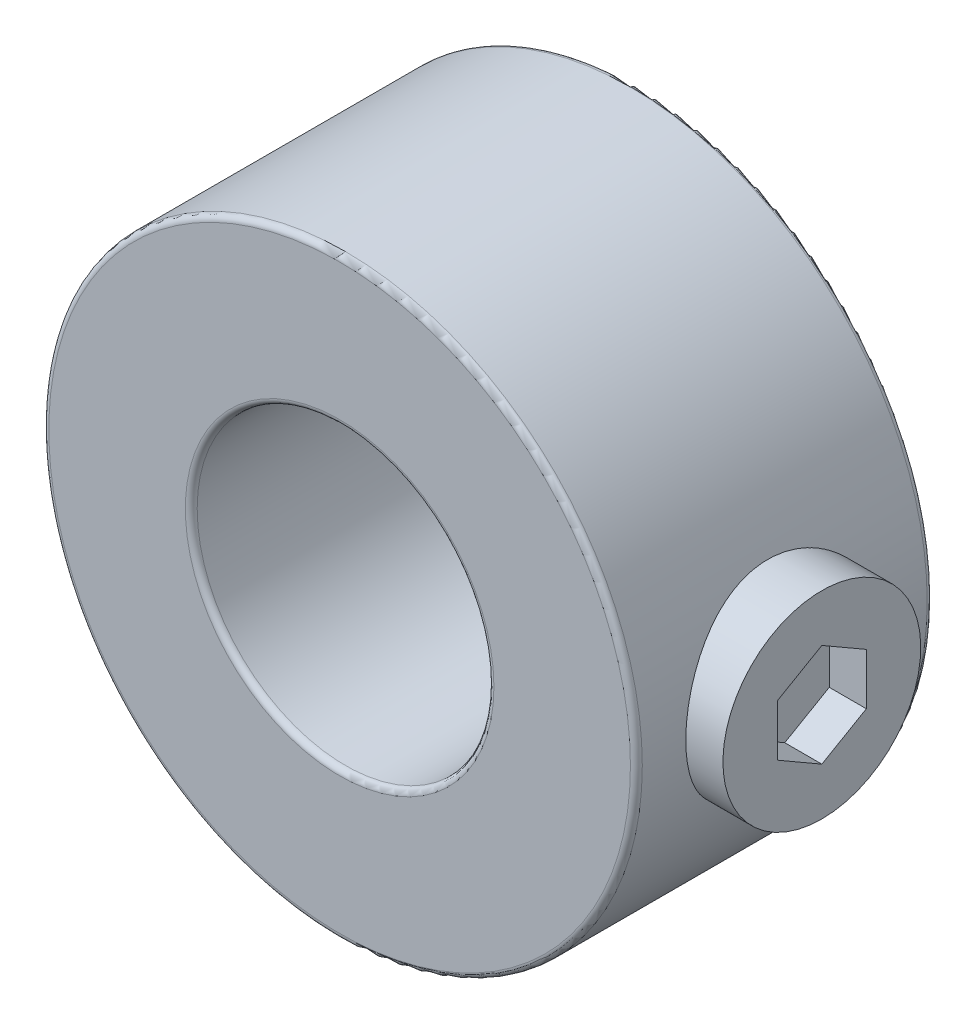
SolidWorks part; units mm, degrees
ref_plane "Front Plane" through (0, 0, 0) normal (0, 0, 1) x (1, 0, 0)
ref_plane "Top Plane" through (0, 0, 0) normal (0, 1, 0) x (1, 0, 0)
ref_plane "Right Plane" through (0, 0, 0) normal (1, 0, 0) x (0, 0, -1)
sketch "Sketch1" plane through (0, 0, 0) normal (0, 0, 1) x (1, 0, 0)
  circle A0 centre (0, 0) radius 9.525
  circle A1 centre (0, 0) radius 4.7625
  point P4 (9.525, 0)
  dimension "Bore Dia" = 9.525
  dimension "OD" = 19.05
extrude "Extrude1" add sketch "Sketch1" along normal blind 9.525
ref_plane "Plane1" through (9.525, 0, 0) normal (1, 0, 0) x (0, 0, -1)
sketch "Sketch2" plane through (9.525, 0, 0) normal (1, 0, 0) x (0, 0, -1)
  line L0 (0, 0) -> (-9.525, 0) construction
  line L1 (-9.525, 9.525) -> (-9.525, -9.525) construction
  circle A0 centre (-4.7625, 0) radius 3.175
  dimension "Set Screw Dia" = 6.35
extrude "Cut-Extrude1" cut sketch "Sketch2" against normal up to surface (9.525 mm away)
ref_plane "Plane2" through (0, 0, 4.7625) normal (0, 0, 1) x (1, 0, 0)
sketch "Sketch3" plane through (0, 0, 4.7625) normal (0, 0, 1) x (1, 0, 0)
  line L1 (5.9531, 0) -> (10.7156, 0)
  line L2 (5.9531, 0) -> (5.9531, 3.175)
  line L3 (5.9531, 3.175) -> (10.7156, 3.175)
  line L4 (10.7156, 0) -> (10.7156, 3.175)
  line L5 (5.9531, 0) -> (0, 0) construction
  dimension "D1" = 4.7625
  dimension "D2" = 1.1906
  dimension "D3" = 6.35
revolve "Revolve1" add sketch "Sketch3" angle 360 about L1
sketch "Sketch4" plane through (10.7156, 0, 0) normal (1, 0, 0) x (0, 0, -1)
  line L1 (-4.7625, 1.6498) -> (-6.1912, 0.8249)
  line L2 (-6.1912, 0.8249) -> (-6.1912, -0.8249)
  line L3 (-6.1912, -0.8249) -> (-4.7625, -1.6498)
  line L4 (-4.7625, -1.6498) -> (-3.3337, -0.8249)
  line L5 (-3.3337, -0.8249) -> (-3.3337, 0.8249)
  line L6 (-3.3337, 0.8249) -> (-4.7625, 1.6498)
  circle A0 centre (-4.7625, 0) radius 1.4287 construction
  dimension "D1" = 2.8575
extrude "Cut-Extrude2" cut sketch "Sketch4" against normal up to vertex (1.1906 mm away)
fillet "Fillet1" radius 0.1905 4 edges at (4.7625, 0, 0) (4.7625, 0, 9.525) (9.525, 0, 0) (9.525, 0, 9.525)
equation "\"D1@Sketch3\" = (\"OD@Sketch1\"-\"Bore Dia@Sketch1\")/2"
equation "\"D2@Sketch3\" = \"D1@Sketch3\"/4"
equation "\"D1@Sketch4\" = \"Set Screw Dia@Sketch2\"*.45"
equation "\"D3@Sketch3\" = \"Set Screw Dia@Sketch2\""
equation "\"D1@Fillet1\" = \"OD@Sketch1\"*.01"
